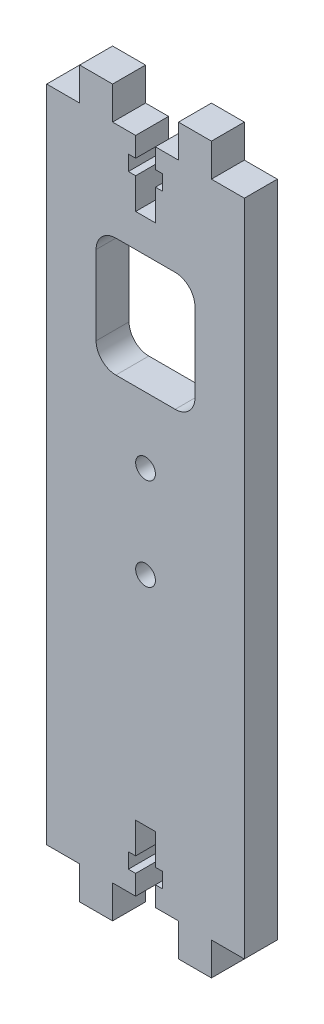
SolidWorks part; units mm, degrees
ref_plane "Plan de face" through (0, 0, 0) normal (0, 0, 1) x (1, 0, 0)
ref_plane "Plan de dessus" through (0, 0, 0) normal (0, 1, 0) x (1, 0, 0)
ref_plane "Plan de droite" through (0, 0, 0) normal (1, 0, 0) x (0, 0, -1)
sketch "Esquisse1" plane through (0, 0, 0) normal (0, 0, 1) x (1, 0, 0)
  line L0 (-10, 0) -> (-15, 0)
  line L1 (-15, 0) -> (-15, 100)
  line L2 (-15, 100) -> (15, 100) construction
  line L3 (15, 100) -> (15, 0)
  line L4 (15, 0) -> (10, 0)
  line L5 (0, 0) -> (0, 11.2208) construction
  line L6 (-1.5, 0) -> (-5, 0)
  line L7 (-5, -5) -> (-10, -5)
  line L8 (-10, -5) -> (-10, 0)
  line L9 (-5, -5) -> (-5, 0)
  line L10 (1.5, 0) -> (5, 0)
  line L11 (5, 0) -> (5, -5)
  line L12 (0, 0) -> (0, 82.5) construction
  line L13 (5, -5) -> (10, -5)
  line L14 (10, -5) -> (10, 0)
  line L15 (-1.5, 0) -> (1.5, 0) construction
  line L16 (1.5, 0) -> (1.5, 3)
  line L17 (1.5, 5.3) -> (2.6, 5.3)
  line L18 (-2.6, 3) -> (-2.6, 5.3)
  line L19 (2.6, 3) -> (1.5, 3)
  line L20 (1.5, 5.3) -> (1.5, 10)
  line L21 (1.5, 10) -> (-1.5, 10)
  line L22 (-1.5, 10) -> (-1.5, 5.3)
  line L23 (-1.5, 3) -> (-2.6, 3)
  line L24 (2.6, 5.3) -> (2.6, 3)
  line L25 (-2.6, 5.3) -> (-1.5, 5.3)
  line L26 (-1.5, 3) -> (-1.5, 0)
  line L27 (0, 10) -> (0, 0) construction
  line L28 (-10, 100) -> (-15, 100)
  line L29 (10, 100) -> (15, 100)
  line L30 (0, 100) -> (0, 78.7792) construction
  line L31 (1.5, 100) -> (5, 100)
  line L32 (5, 105) -> (10, 105)
  line L33 (10, 105) -> (10, 100)
  line L34 (5, 105) -> (5, 100)
  line L35 (-1.5, 100) -> (-5, 100)
  line L36 (-5, 100) -> (-5, 105)
  line L37 (-5, 105) -> (-10, 105)
  line L38 (-10, 105) -> (-10, 100)
  line L39 (1.5, 100) -> (-1.5, 100) construction
  line L40 (-1.5, 100) -> (-1.5, 97)
  line L41 (-1.5, 94.7) -> (-2.6, 94.7)
  line L42 (2.6, 97) -> (2.6, 94.7)
  line L43 (-2.6, 97) -> (-1.5, 97)
  line L44 (-1.5, 94.7) -> (-1.5, 90)
  line L45 (-1.5, 90) -> (1.5, 90)
  line L46 (1.5, 90) -> (1.5, 94.7)
  line L47 (1.5, 97) -> (2.6, 97)
  line L48 (-2.6, 94.7) -> (-2.6, 97)
  line L49 (2.6, 94.7) -> (1.5, 94.7)
  line L50 (1.5, 97) -> (1.5, 100)
  line L51 (0, 90) -> (0, 100) construction
  line L53 (-7.5, 85) -> (7.5, 85)
  line L54 (-7.5, 85) -> (-7.5, 67)
  line L55 (-7.5, 67) -> (7.5, 67)
  line L56 (7.5, 85) -> (7.5, 67)
  circle A0 centre (0, 57) radius 1.5
  circle A1 centre (0, 43) radius 1.5
  dimension "D3" = 30
  dimension "D6" = 3
  dimension "D1" = 14
  dimension "D2" = 100
  dimension "D4" = 10
  dimension "D5" = 43
  dimension "D7" = 10
  dimension "D8" = 5
  dimension "D9" = 5
  dimension "D10" = 5.2
  dimension "D11" = 3
  dimension "D12" = 2.3
  dimension "D13" = 3
  dimension "D14" = 10
  dimension "D15" = 5
  dimension "D16" = 5
  dimension "D17" = 5.2
  dimension "D18" = 3
  dimension "D19" = 2.3
  dimension "D20" = 3
  dimension "D21" = 10
  dimension "D22" = 15
  dimension "D23" = 18
  dimension "D24" = 15
extrude "Boss.-Extru.1" add sketch "Esquisse1" along normal blind 5
fillet "Fillet1" radius 3 4 edges at (7.5, 67, 2.5) (-7.5, 67, 2.5) (-7.5, 85, 2.5) (7.5, 85, 2.5)
